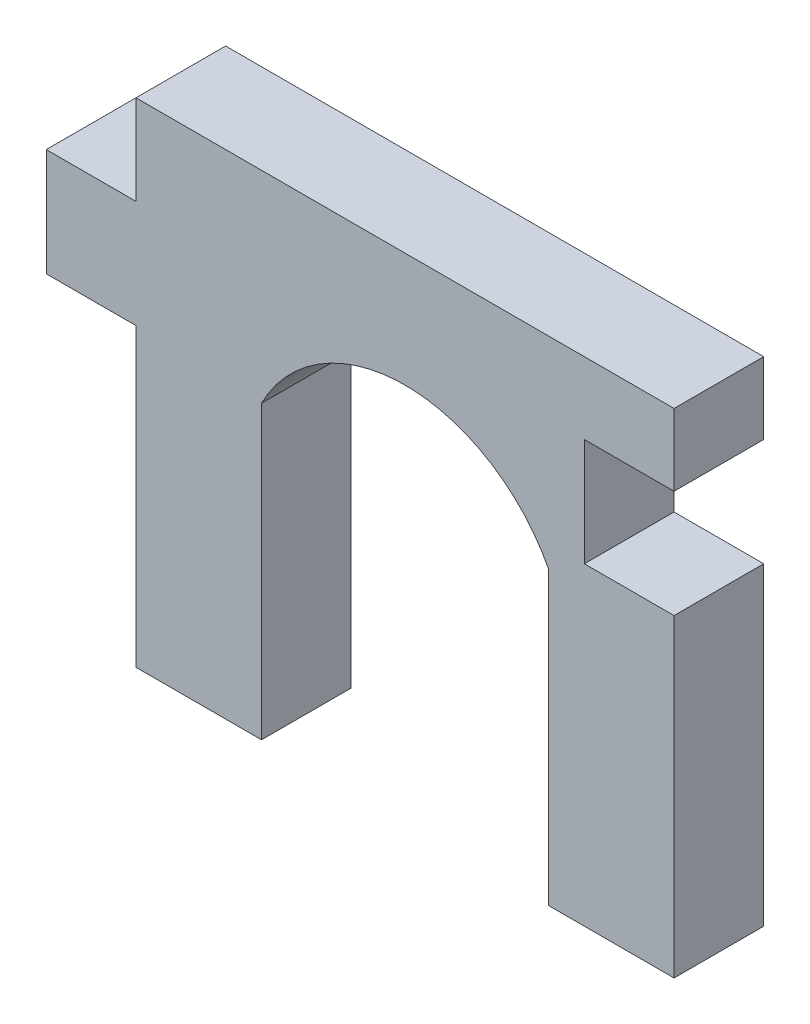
SolidWorks part; units mm, degrees
ref_plane "Front Plane" through (0, 0, 0) normal (0, 0, 1) x (1, 0, 0)
ref_plane "Top Plane" through (0, 0, 0) normal (0, 1, 0) x (1, 0, 0)
ref_plane "Right Plane" through (0, 0, 0) normal (1, 0, 0) x (0, 0, -1)
sketch "Sketch1" plane through (0, 0, 0) normal (0, 0, 1) x (1, 0, 0)
  line L1 (0, 0) -> (-38.1, 0)
  line L2 (0, 0) -> (0, 28.575)
  line L3 (0, 28.575) -> (-38.1, 28.575)
  line L4 (-38.1, 0) -> (-38.1, 28.575)
  line L5 (-29.21, 0) -> (-8.89, 0)
  line L6 (-29.21, 0) -> (-29.21, 14.29)
  line L7 (-29.21, 14.29) -> (-8.89, 14.29)
  line L8 (-8.89, 0) -> (-8.89, 14.29)
  line L9 (-38.1, 22.225) -> (-44.45, 22.225)
  line L10 (-38.1, 22.225) -> (-38.1, 14.605)
  line L11 (-38.1, 14.605) -> (-44.45, 14.605)
  line L12 (-44.45, 22.225) -> (-44.45, 14.605)
  line L17 (-38.1, 0) -> (-29.21, 0)
  line L18 (-38.1, 0) -> (-38.1, -6.35)
  line L19 (-38.1, -6.35) -> (-29.21, -6.35)
  line L20 (-29.21, 0) -> (-29.21, -6.35)
  line L21 (-8.89, 0) -> (0, 0)
  line L22 (-8.89, 0) -> (-8.89, -6.35)
  line L23 (-8.89, -6.35) -> (0, -6.35)
  line L24 (0, 0) -> (0, -6.35)
  arc A0 (-29.21, 14.29) -> (-8.89, 14.29) centre (-19.05, 9.0537) cw
  dimension "D6" = 11.43
  dimension "D1" = 28.575
  dimension "D2" = 38.1
  dimension "D3" = 14.29
  dimension "D4" = 20.32
  dimension "D5" = 8.89
  dimension "D7" = 6.35
  dimension "D8" = 7.62
  dimension "D9" = 6.35
  dimension "D11" = 6.35
  dimension "D14" = 6.35
extrude "Boss-Extrude2" add sketch "Sketch1" along normal blind 6.35
sketch "Sketch2" plane through (0, 0, 6.35) normal (0, 0, 1) x (1, 0, 0)
  line L0 (0, -6.35) -> (0, 28.575) construction
  line L2 (0, 23.495) -> (-6.35, 23.495)
  line L3 (0, 23.495) -> (0, 15.875)
  line L4 (0, 15.875) -> (-6.35, 15.875)
  line L5 (-6.35, 23.495) -> (-6.35, 15.875)
  line L6 (0, 28.575) -> (-38.1, 28.575) construction
  dimension "D1" = 5.08
  dimension "D2" = 7.62
  dimension "D3" = 6.35
extrude "Cut-Extrude1" cut sketch "Sketch2" against normal blind 12.7
